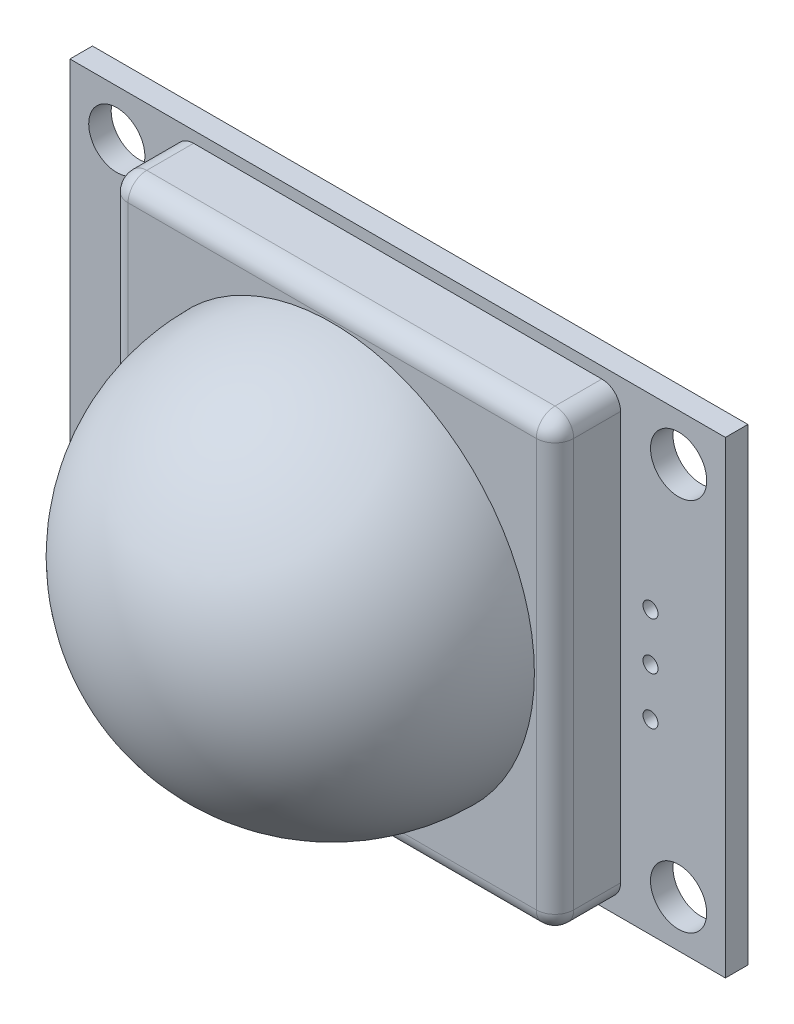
SolidWorks part; units mm, degrees
ref_plane "Plan de face" through (0, 0, 0) normal (0, 0, 1) x (1, 0, 0)
ref_plane "Plan de dessus" through (0, 0, 0) normal (0, 1, 0) x (1, 0, 0)
ref_plane "Plan de droite" through (0, 0, 0) normal (1, 0, 0) x (0, 0, -1)
sketch "Esquisse1" plane through (0, 0, 0) normal (0, 0, 1) x (1, 0, 0)
  line L0 (-5.2892, 12.5) -> (36.046, 12.5) construction
  line L1 (0, 0) -> (35, 0)
  line L2 (0, 0) -> (0, 25)
  line L3 (0, 25) -> (35, 25)
  line L4 (35, 0) -> (35, 25)
  line L5 (17.5, 30.6892) -> (17.5, 9.2498) construction
  line L6 (0, -5.0786) -> (0, 29.9463) construction
  line L7 (-2.6889, 0) -> (40.8799, 0) construction
  line L8 (2.5, -3.858) -> (2.5, 4.5267) construction
  line L9 (11.8517, 2.5) -> (1.0259, 2.5) construction
  line L10 (31, 26.8823) -> (31, 6.9907) construction
  circle A0 centre (2.5, 2.5) radius 1.5
  circle A1 centre (32.5, 2.5) radius 1.5
  circle A2 centre (32.5, 22.5) radius 1.5
  circle A3 centre (2.5, 22.5) radius 1.5
  circle A4 centre (31, 12.5) radius 0.4
  circle A5 centre (31, 15.04) radius 0.4
  circle A6 centre (31, 9.96) radius 0.4
  dimension "D5" = 4
  dimension "D1" = 12.5
  dimension "D2" = 17.5
  dimension "D3" = 2.5
  dimension "D4" = 2.5
extrude "Extrusion1" add sketch "Esquisse1" along normal blind 1.2
sketch "Esquisse2" plane through (0, 0, 1.2) normal (0, 0, 1) x (1, 0, 0)
  line L0 (17.5, -2.7811) -> (17.5, 36.2357) construction
  line L1 (37.037, 12.5) -> (-14.4333, 12.5) construction
  line L2 (0, 25) -> (0, 0) construction
  line L3 (0, 0) -> (35, 0) construction
  line L5 (6.6, 24.4) -> (28.4, 24.4)
  line L6 (5.6, 23.4) -> (5.6, 1.6)
  line L7 (6.6, 0.6) -> (28.4, 0.6)
  line L8 (29.4, 23.4) -> (29.4, 1.6)
  arc A0 (28.4, 24.4) -> (29.4, 23.4) centre (28.4, 23.4) cw
  arc A1 (28.4, 0.6) -> (29.4, 1.6) centre (28.4, 1.6) ccw
  arc A2 (5.6, 1.6) -> (6.6, 0.6) centre (6.6, 1.6) ccw
  arc A3 (6.6, 24.4) -> (5.6, 23.4) centre (6.6, 23.4) ccw
  dimension "D5" = 1
  dimension "D1" = 17.5
  dimension "D2" = 12.5
  dimension "D3" = 11.9
  dimension "D4" = 11.9
extrude "Extrusion2" add sketch "Esquisse2" along normal blind 3.5
fillet "Congé1" radius 1 8 edges at (29.1071, 24.1071, 4.7) (17.5, 24.4, 4.7) (5.8929, 24.1071, 4.7) (5.6, 12.5, 4.7) (5.8929, 0.8929, 4.7) (17.5, 0.6, 4.7) (29.1071, 0.8929, 4.7) (29.4, 12.5, 4.7)
ref_plane "Plan1" through (0, 12.5, 0) normal (0, 1, 0) x (-1, 0, 0)
sketch "Esquisse3" plane through (0, 12.5, 0) normal (0, 1, 0) x (-1, 0, 0)
  line L0 (-35, 1.7735) -> (-35, 23.0413) construction
  line L1 (-17.5, -1.6656) -> (-17.5, 22.2721) construction
  line L2 (-40.7969, 4.7) -> (-14.1443, 4.7) construction
  arc A0 (-17.5, 15.5) -> (-28.3, 4.7) centre (-17.5, 4.7) ccw
  dimension "D1" = 17.5
revolve "Révol.-Mince1" add sketch "Esquisse3" angle 360 about L1
